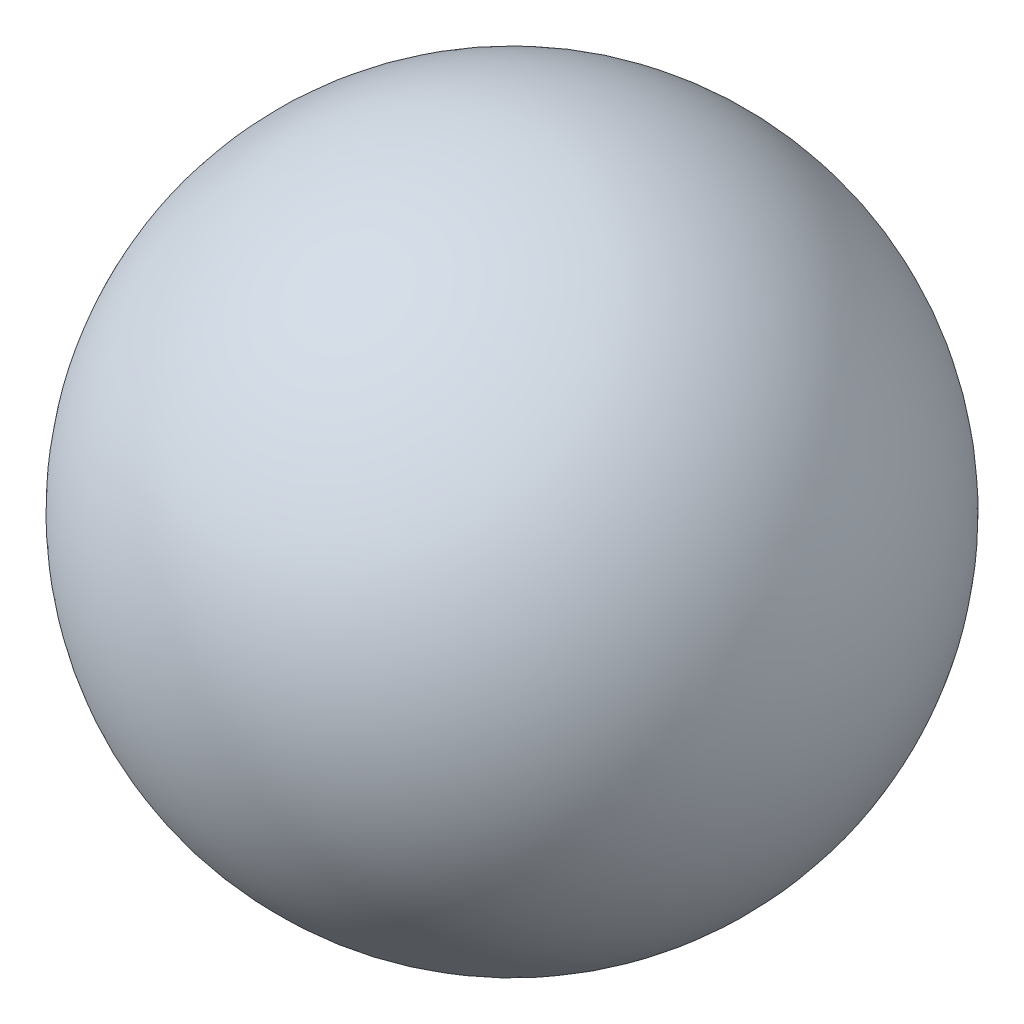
SolidWorks part; units mm, degrees
ref_plane "Plan1" through (0, 0, 0) normal (0, 0, 1) x (1, 0, 0)
ref_plane "Plan2" through (0, 0, 0) normal (0, 1, 0) x (1, 0, 0)
ref_plane "Plan3" through (0, 0, 0) normal (1, 0, 0) x (0, 0, -1)
sketch "Esquisse1" plane through (0, 0, 0) normal (0, 1, 0) x (1, 0, 0)
  line L1 (-0.6, 4.4) -> (10.4, 4.4) construction
  line L2 (-0.6, 8.8) -> (-0.6, 0) construction
  line L3 (10.4, 8.8) -> (10.4, 0) construction
  line L4 (1.9, 4.4) -> (7.9, 4.4)
  circle A1 centre (4.9, 4.4) radius 3 construction
  arc A2 (7.9, 4.4) -> (1.9, 4.4) centre (4.9, 4.4) ccw
revolve "Base-Révolution" add sketch "Esquisse1" angle 360 about L1
